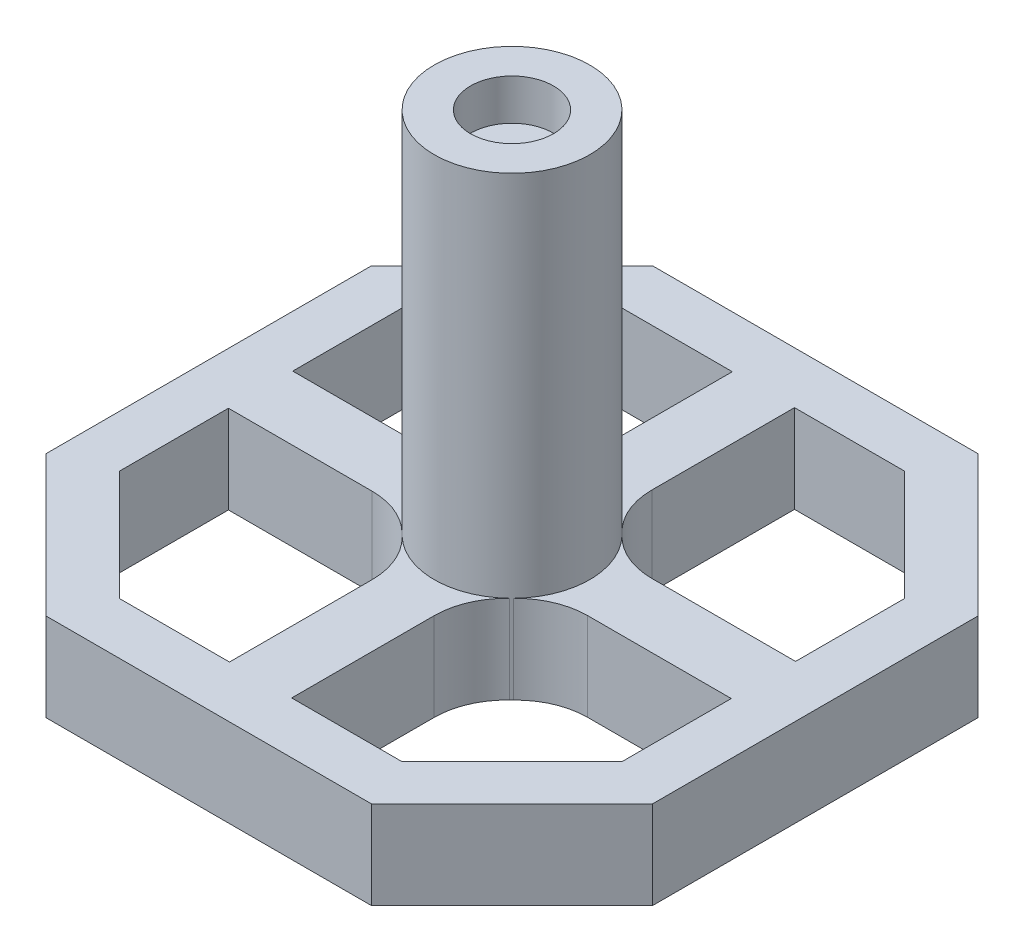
SolidWorks part; units mm, degrees
ref_plane "Front Plane" through (0, 0, 0) normal (0, 0, 1) x (1, 0, 0)
ref_plane "Top Plane" through (0, 0, 0) normal (0, 1, 0) x (1, 0, 0)
ref_plane "Right Plane" through (0, 0, 0) normal (1, 0, 0) x (0, 0, -1)
sketch "Sketch2" plane through (0, 0, 0) normal (0, 1, 0) x (1, 0, 0)
  circle A0 centre (0, 0) radius 3.81
  dimension "D1" = 7.62
extrude "Boss-Extrude1" add sketch "Sketch2" along normal blind 22.352
sketch "Sketch3" plane through (0, 0, 0) normal (0, -1, 0) x (1, 0, 0)
  line L0 (6.9215, -12.319) -> (1.524, -12.319)
  line L1 (-12.319, 1.5748) -> (12.319, 1.5748)
  line L2 (-12.319, 1.5748) -> (-12.319, -1.5748) construction
  line L3 (-12.319, -1.5748) -> (12.319, -1.5748)
  line L4 (12.319, 1.5748) -> (12.319, -1.5748) construction
  line L5 (-12.319, 1.5748) -> (12.319, -1.5748) construction
  line L6 (-12.319, -1.5748) -> (12.319, 1.5748) construction
  line L7 (-1.524, 12.319) -> (1.524, 12.319) construction
  line L8 (-1.524, 12.319) -> (-1.524, -12.319)
  line L9 (-1.524, -12.319) -> (1.524, -12.319) construction
  line L10 (1.524, 12.319) -> (1.524, -12.319)
  line L11 (-1.524, 12.319) -> (1.524, -12.319) construction
  line L12 (-1.524, -12.319) -> (1.524, 12.319) construction
  line L13 (-12.319, -6.9215) -> (-6.9215, -12.319)
  line L14 (-1.524, -12.319) -> (-6.9215, -12.319)
  line L15 (6.9215, -12.319) -> (12.319, -6.9215)
  line L16 (12.319, -6.9215) -> (12.319, -1.5748)
  line L17 (12.319, 6.9215) -> (6.9215, 12.319)
  line L18 (-12.319, -6.9215) -> (-12.319, -1.5748)
  line L19 (-6.9215, 12.319) -> (-12.319, 6.9215)
  line L20 (-6.9215, -12.319) -> (-12.319, -12.319) construction
  line L21 (-12.319, -12.319) -> (-12.319, -6.9215) construction
  line L22 (-12.319, 6.9215) -> (-12.319, 12.319) construction
  line L23 (-12.319, 12.319) -> (-6.9215, 12.319) construction
  line L24 (6.9215, -12.319) -> (12.319, -12.319) construction
  line L25 (12.319, -12.319) -> (12.319, -6.9215) construction
  line L26 (12.319, 6.9215) -> (12.319, 12.319) construction
  line L27 (12.319, 12.319) -> (6.9215, 12.319) construction
  line L28 (9.6202, -9.6202) -> (-9.6202, 9.6202) construction
  line L29 (9.6202, 9.6202) -> (-9.6202, -9.6202) construction
  line L30 (7.9736, -14.859) -> (-7.9736, -14.859)
  line L31 (-7.9736, -14.859) -> (-14.859, -7.9736)
  line L32 (-14.859, -7.9736) -> (-14.859, 7.9736)
  line L33 (-14.859, 7.9736) -> (-7.9736, 14.859)
  line L34 (-7.9736, 14.859) -> (7.9736, 14.859)
  line L35 (7.9736, 14.859) -> (14.859, 7.9736)
  line L37 (14.859, -7.9736) -> (7.9736, -14.859)
  line L38 (7.9736, -14.859) -> (6.9215, -12.319) construction
  line L39 (12.319, 1.5748) -> (12.319, 6.9215)
  line L40 (14.859, -7.9736) -> (14.859, 7.9736)
  line L41 (-12.319, 1.5748) -> (-12.319, 6.9215)
  line L42 (-6.9215, 12.319) -> (-1.524, 12.319)
  line L43 (1.524, 12.319) -> (6.9215, 12.319)
  point P0 (0, 0)
  point P6 (0, 0)
  point P30 (0, 0)
  dimension "D4" = 13.843
  dimension "D1" = 3.1496
  dimension "D2" = 3.048
  dimension "D3" = 24.638
  dimension "D5" = 2.54
  dimension "D6" = 2.54
  dimension "D7" = 2.54
  dimension "D8" = 2.54
  dimension "D9" = 2.54
  dimension "D10" = 2.54
  dimension "D11" = 2.54
  dimension "D12" = 2.54
extrude "Adapter Holders" add sketch "Sketch3" against normal blind 4.318 contours L37 L40 L35 L34 L33 L32 L31 L30 L10 L43 L17 L39 L1 L3 L16 L15 L0 L8 L14 L13 L18 L41 L19 L42 M9
fillet "Fillet1" radius 3.556 8 edges at (1.524, 2.159, -3.4919) (1.524, 2.159, 3.4919) (3.4693, 2.159, -1.5748) (-3.4693, 2.159, -1.5748) (-1.524, 2.159, -3.4919) (-1.524, 2.159, 3.4919) (-3.4693, 2.159, 1.5748) (3.4693, 2.159, 1.5748)
sketch "Sketch4" plane through (0, 22.352, 0) normal (0, 1, 0) x (1, 0, 0)
  circle A0 centre (0, 0) radius 2.032
  dimension "D1" = 4.064
extrude "Magnet Hole" cut sketch "Sketch4" against normal blind 2.0066
